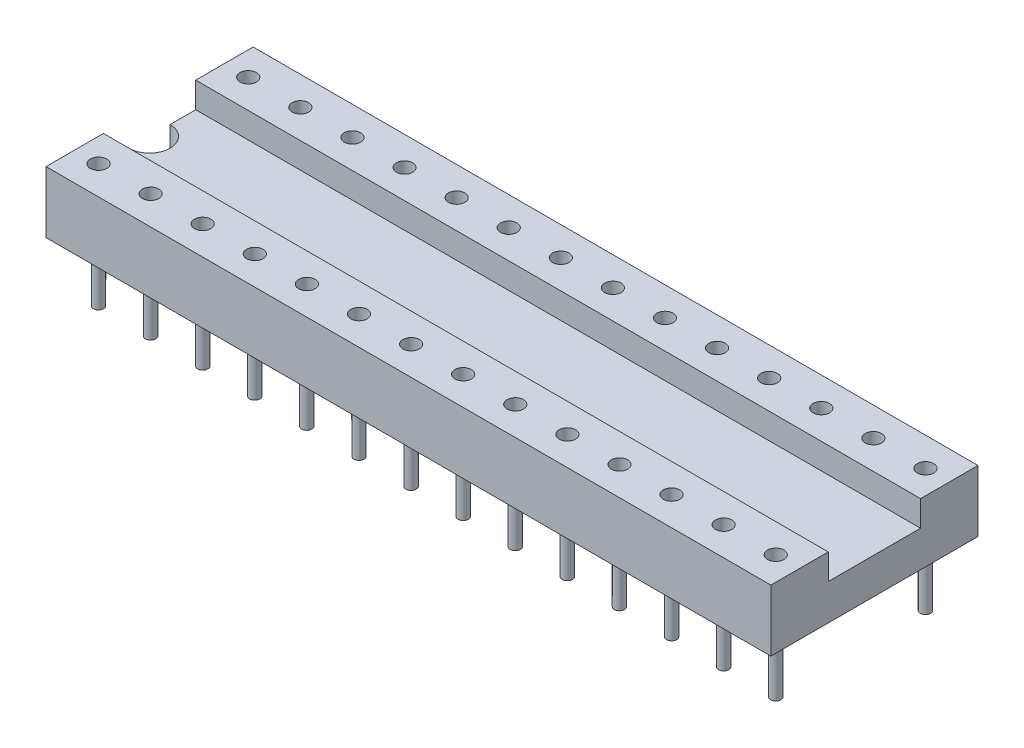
SolidWorks part; units mm, degrees
ref_plane "Plan de face" through (0, 0, 0) normal (0, 0, 1) x (1, 0, 0)
ref_plane "Plan de dessus" through (0, 0, 0) normal (0, 1, 0) x (1, 0, 0)
ref_plane "Plan de droite" through (0, 0, 0) normal (1, 0, 0) x (0, 0, -1)
sketch "Esquisse1" plane through (0, 0, 0) normal (1, 0, 0) x (0, 0, -1)
  line L0 (12.2051, 0) -> (-23.3437, 0) construction
  line L1 (0, -4.6214) -> (0, 25.9507) construction
  line L2 (-5.7968, 1.75) -> (2.763, 1.75) construction
  line L3 (5.7565, 3) -> (-6.8307, 3) construction
  line L4 (5.05, 3.8077) -> (5.05, -1.0493) construction
  line L5 (-5.05, 3.7235) -> (-5.05, -1.0493) construction
  line L6 (-2.25, 3.5071) -> (-2.25, 0.8142) construction
  line L7 (2.25, 3.5071) -> (2.25, 0.8142) construction
  line L8 (-2.25, 1.75) -> (-2.25, 3)
  line L9 (-2.25, 3) -> (-5.05, 3)
  line L10 (-5.05, 3) -> (-5.05, 0)
  line L11 (-5.05, 0) -> (5.05, 0)
  line L12 (5.05, 0) -> (5.05, 3)
  line L13 (5.05, 3) -> (2.25, 3)
  line L14 (2.25, 3) -> (2.25, 1.75)
  line L15 (2.25, 1.75) -> (-2.25, 1.75)
  dimension "D1" = 1.75
  dimension "D2" = 3
  dimension "D3" = 5.05
  dimension "D4" = 5.05
  dimension "D5" = 2.8
  dimension "D6" = 2.8
extrude "Extrusion1" add sketch "Esquisse1" along normal blind 35.34
sketch "Esquisse2" plane through (0, 1.75, 0) normal (0, 1, 0) x (-1, 0, 0)
  line L0 (0, -1) -> (0, 1)
  arc A0 (0, 1) -> (0, -1) centre (0, 0) ccw
extrude "Enlèv. mat.-Extru.1" cut sketch "Esquisse2" against normal through all
sketch "Esquisse3" plane through (0, 3, 0) normal (0, 1, 0) x (-1, 0, 0)
  line L0 (-13.1576, 5.05) -> (2.3638, 5.05) construction
  line L1 (0, 6.1465) -> (0, -6.3771) construction
  line L2 (1.5124, 0) -> (-12.9979, 0) construction
  line L3 (1.0512, 3.65) -> (-15.6055, 3.65) construction
  line L4 (-1.16, 6.2884) -> (-1.16, 1.7827) construction
  circle A0 centre (-1.16, 3.65) radius 0.4
  circle A1 centre (-1.16, -3.65) radius 0.4
  circle A2 centre (-3.7, 3.65) radius 0.4
  circle A3 centre (-3.7, -3.65) radius 0.4
  circle A4 centre (-6.24, 3.65) radius 0.4
  circle A5 centre (-6.24, -3.65) radius 0.4
  circle A6 centre (-8.78, 3.65) radius 0.4
  circle A7 centre (-8.78, -3.65) radius 0.4
  circle A8 centre (-11.32, 3.65) radius 0.4
  circle A9 centre (-11.32, -3.65) radius 0.4
  circle A10 centre (-13.86, 3.65) radius 0.4
  circle A11 centre (-13.86, -3.65) radius 0.4
  circle A12 centre (-16.4, 3.65) radius 0.4
  circle A13 centre (-16.4, -3.65) radius 0.4
  circle A14 centre (-18.94, 3.65) radius 0.4
  circle A15 centre (-18.94, -3.65) radius 0.4
  circle A16 centre (-21.48, 3.65) radius 0.4
  circle A17 centre (-21.48, -3.65) radius 0.4
  circle A18 centre (-24.02, 3.65) radius 0.4
  circle A19 centre (-24.02, -3.65) radius 0.4
  circle A20 centre (-26.56, 3.65) radius 0.4
  circle A21 centre (-26.56, -3.65) radius 0.4
  circle A22 centre (-29.1, 3.65) radius 0.4
  circle A23 centre (-29.1, -3.65) radius 0.4
  circle A24 centre (-31.64, 3.65) radius 0.4
  circle A25 centre (-31.64, -3.65) radius 0.4
  circle A26 centre (-34.18, 3.65) radius 0.4
  circle A27 centre (-34.18, -3.65) radius 0.4
  dimension "D1" = 1.4
  dimension "D2" = 1.16
extrude "Enlèv. mat.-Extru.2" cut sketch "Esquisse3" against normal blind 2.5
sketch "Esquisse5" plane through (0, 0, 0) normal (0, -1, 0) x (1, 0, 0)
  line L0 (-0.4263, 0) -> (10.6481, 0) construction
  circle A0 centre (1.16, 3.65) radius 0.25
  circle A1 centre (1.16, -3.65) radius 0.25
  circle A2 centre (3.7, -3.65) radius 0.25
  circle A3 centre (3.7, 3.65) radius 0.25
  circle A4 centre (6.24, -3.65) radius 0.25
  circle A5 centre (6.24, 3.65) radius 0.25
  circle A6 centre (8.78, -3.65) radius 0.25
  circle A7 centre (8.78, 3.65) radius 0.25
  circle A8 centre (11.32, -3.65) radius 0.25
  circle A9 centre (11.32, 3.65) radius 0.25
  circle A10 centre (13.86, -3.65) radius 0.25
  circle A11 centre (13.86, 3.65) radius 0.25
  circle A12 centre (16.4, -3.65) radius 0.25
  circle A13 centre (16.4, 3.65) radius 0.25
  circle A14 centre (18.94, -3.65) radius 0.25
  circle A15 centre (18.94, 3.65) radius 0.25
  circle A16 centre (21.48, -3.65) radius 0.25
  circle A17 centre (21.48, 3.65) radius 0.25
  circle A18 centre (24.02, -3.65) radius 0.25
  circle A19 centre (24.02, 3.65) radius 0.25
  circle A20 centre (26.56, -3.65) radius 0.25
  circle A21 centre (26.56, 3.65) radius 0.25
  circle A22 centre (29.1, -3.65) radius 0.25
  circle A23 centre (29.1, 3.65) radius 0.25
  circle A24 centre (31.64, -3.65) radius 0.25
  circle A25 centre (31.64, 3.65) radius 0.25
  circle A26 centre (34.18, -3.65) radius 0.25
  circle A27 centre (34.18, 3.65) radius 0.25
extrude "Extrusion2" add sketch "Esquisse5" along normal blind 3
